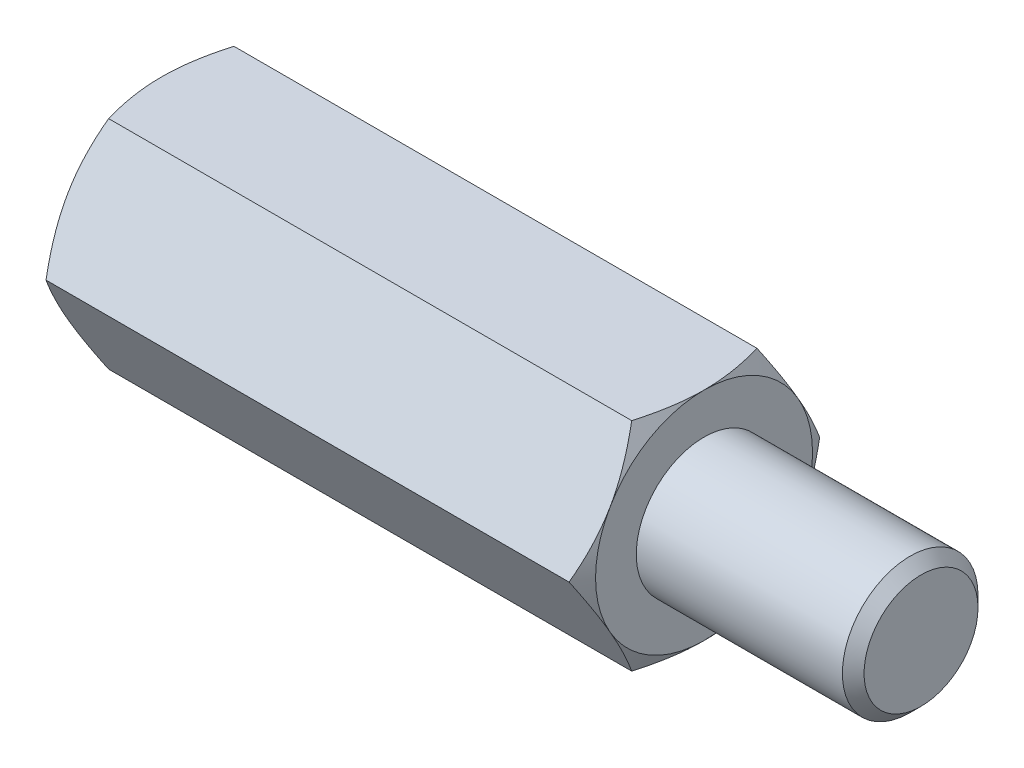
SolidWorks part; units mm, degrees
ref_plane "Front Plane" through (0, 0, 0) normal (0, 0, 1) x (1, 0, 0)
ref_plane "Top Plane" through (0, 0, 0) normal (0, 1, 0) x (1, 0, 0)
ref_plane "Right Plane" through (0, 0, 0) normal (1, 0, 0) x (0, 0, -1)
sketch "Sketch1" plane through (0, 0, 0) normal (1, 0, 0) x (0, 0, -1)
  line L1 (2.3094, 4) -> (-2.3094, 4)
  line L2 (-2.3094, 4) -> (-4.6188, 0)
  line L3 (-4.6188, 0) -> (-2.3094, -4)
  line L4 (-2.3094, -4) -> (2.3094, -4)
  line L5 (2.3094, -4) -> (4.6188, 0)
  line L6 (4.6188, 0) -> (2.3094, 4)
  circle A0 centre (0, 0) radius 4 construction
  dimension "D1" = 8
extrude "Extrude2" add sketch "Sketch1" along normal mid plane 20
sketch "Sketch2" plane through (0, 0, 0) normal (0, 0, 1) x (1, 0, 0)
  line L0 (-10, 4) -> (-8.5, 6.5981)
  line L1 (-10, 7) -> (-10, 4)
  line L3 (0, 0) -> (50000, 0) construction
  arc A0 (-8.5, 6.5981) -> (-10, 7) centre (-9.1962, 7) ccw
  dimension "D1" = 30
  dimension "D2" = 3
revolve "Cut-Revolve1" cut sketch "Sketch2" angle 360 about L3
mirror "Mirror1" about plane through (0, 0, 0) normal (1, 0, 0) of "Cut-Revolve1"
sketch "Sketch3" plane through (-10, 0, 0) normal (-1, 0, 0) x (0, 0, 1)
  circle A0 centre (0, 0) radius 2.1
  dimension "D1" = 4.2
extrude "Extrude3" cut sketch "Sketch3" against normal blind 8
sketch "Sketch4" plane through (0, 0, 0) normal (0, 0, 1) x (1, 0, 0)
  line L0 (-2, 0) -> (-2, 2.1)
  line L1 (9.6427, 0) -> (-9.6427, 0) construction
  line L2 (-2, 2.1) -> (-0.7876, 0)
  line L3 (-0.7876, 0) -> (-2, 0)
  line L4 (-10, 2) -> (-10, -2) construction
  point P4 (-10, 0)
  dimension "D1" = 30
  dimension "D2" = 2.1
  dimension "D3" = 8
revolve "Cut-Revolve2" cut sketch "Sketch4" angle 360 about L3
sketch "Sketch5" plane through (10, 0, 0) normal (1, 0, 0) x (0, 0, -1)
  circle A0 centre (0, 0) radius 2.5
  dimension "D1" = 5
extrude "Extrude4" add sketch "Sketch5" along normal blind 8
chamfer "Chamfer1" distance 0.4 angle 45 1 edges at (18, 0, -2.5)
equation "\"D2@Sketch4\" = \"D1@Sketch3\"/2"
